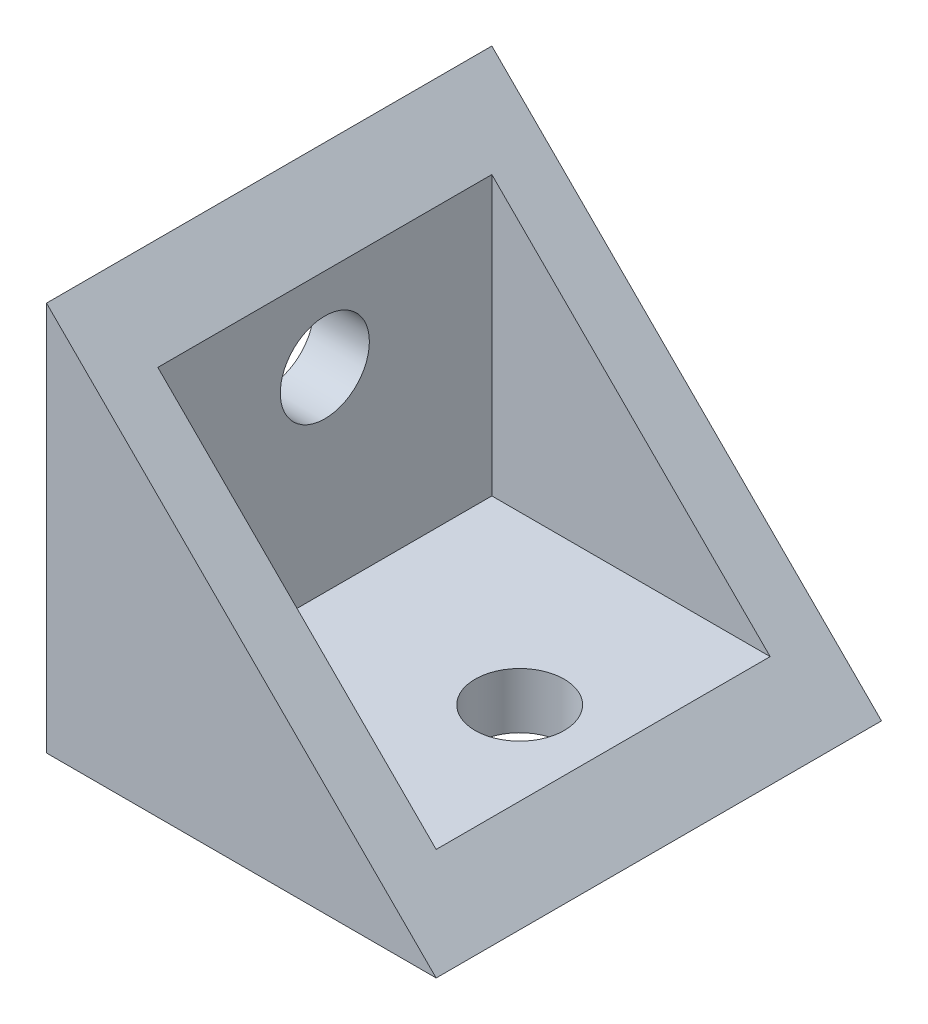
SolidWorks part; units mm, degrees
ref_plane "Front Plane" through (0, 0, 0) normal (0, 0, 1) x (1, 0, 0)
ref_plane "Top Plane" through (0, 0, 0) normal (0, 1, 0) x (1, 0, 0)
ref_plane "Right Plane" through (0, 0, 0) normal (1, 0, 0) x (0, 0, -1)
sketch "Sketch1" plane through (0, 0, 0) normal (0, 0, 1) x (1, 0, 0)
  line L0 (-17.5, 17.5) -> (17.5, -17.5)
  line L1 (-17.5, -17.5) -> (17.5, -17.5)
  line L2 (-17.5, -17.5) -> (-17.5, 17.5)
  line L5 (-17.5, -17.5) -> (0, 0) construction
  line L6 (-17.5, 17.5) -> (17.5, -17.5) construction
  point P0 (0, 0)
  point P7 (0, 0)
  dimension "D1" = 35
extrude "Boss-Extrude1" add sketch "Sketch1" along normal mid plane 40
shell "Shell2" thickness 5
sketch "Sketch2" plane through (0, -12.5, 0) normal (0, 1, 0) x (1, 0, 0)
  circle A0 centre (5, 0) radius 4
  dimension "D1" = 8
  dimension "D2" = 5
extrude "Cut-Extrude1" cut sketch "Sketch2" against normal through all
sketch "Sketch3" plane through (-12.5, 0, 0) normal (1, 0, 0) x (0, 0, -1)
  circle A0 centre (0, 5) radius 4
  dimension "D1" = 8
  dimension "D2" = 5
extrude "Cut-Extrude2" cut sketch "Sketch3" against normal through all
